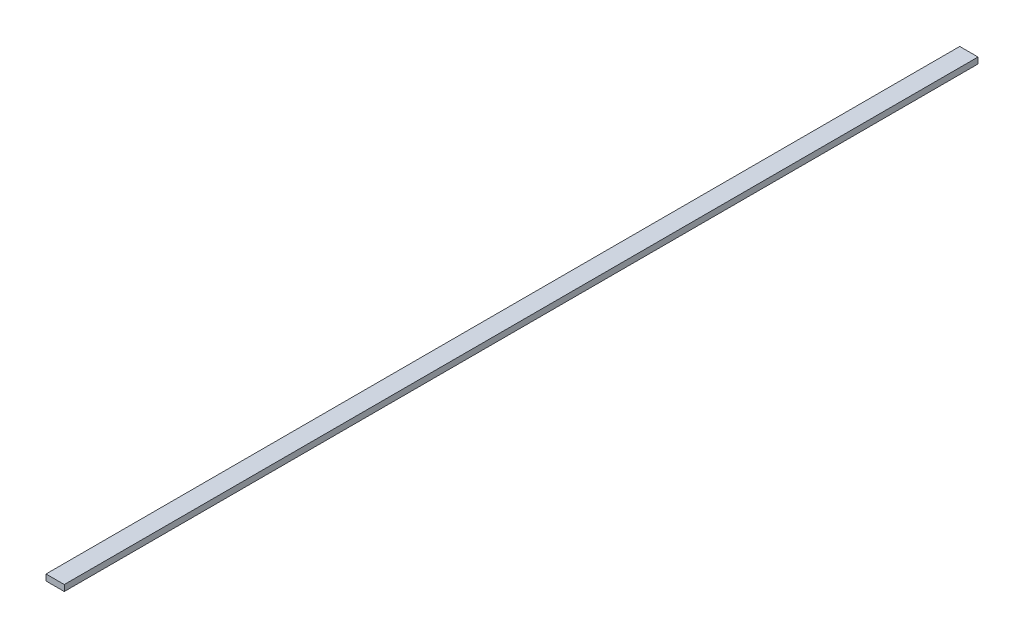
SolidWorks part; units mm, degrees
ref_plane "Front Plane" through (0, 0, 0) normal (0, 0, 1) x (1, 0, 0)
ref_plane "Top Plane" through (0, 0, 0) normal (0, 1, 0) x (1, 0, 0)
ref_plane "Right Plane" through (0, 0, 0) normal (1, 0, 0) x (0, 0, -1)
sketch "Sketch1" plane through (0, 0, 0) normal (0, 0, 1) x (1, 0, 0)
  line L1 (-4.7625, -1.5875) -> (4.7625, -1.5875)
  line L2 (-4.7625, -1.5875) -> (-4.7625, 1.5875)
  line L3 (-4.7625, 1.5875) -> (4.7625, 1.5875)
  line L4 (4.7625, -1.5875) -> (4.7625, 1.5875)
  line L5 (-4.7625, -1.5875) -> (4.7625, 1.5875) construction
  line L6 (-4.7625, 1.5875) -> (4.7625, -1.5875) construction
  point P0 (0, 0)
  dimension "D1" = 3.175
  dimension "D2" = 9.525
extrude "Boss-Extrude1" add sketch "Sketch1" along normal blind 476.25
